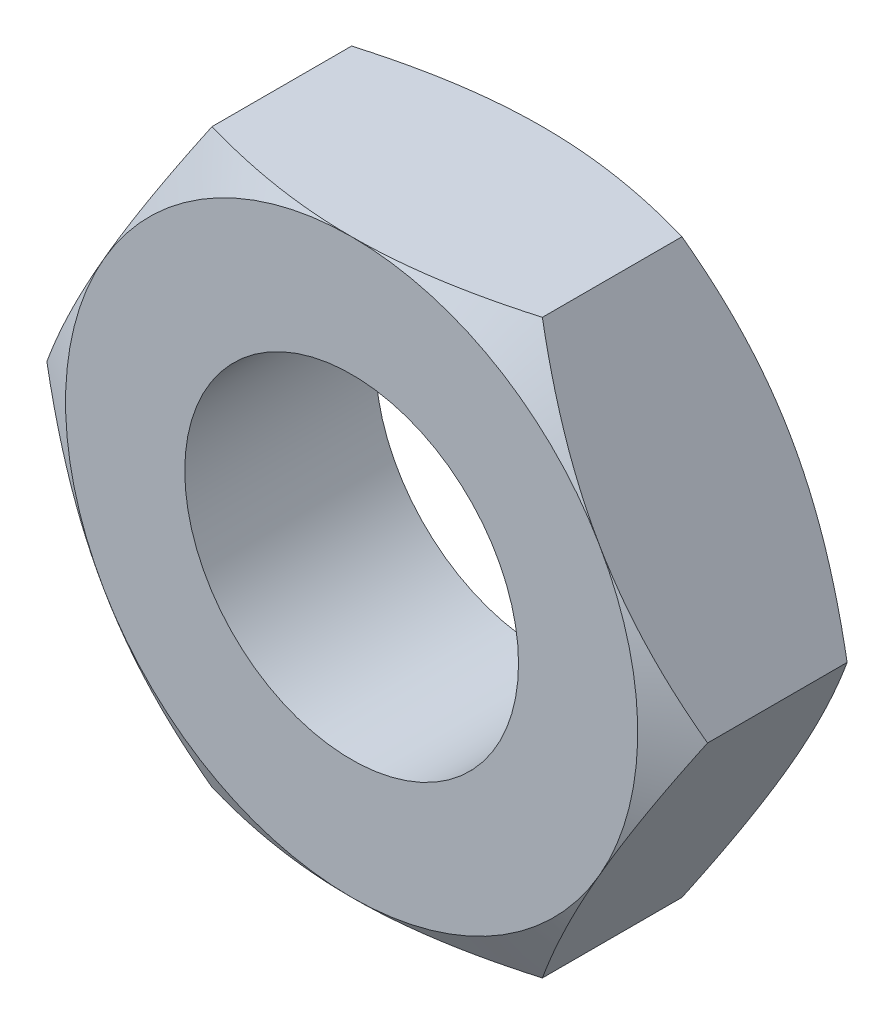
SolidWorks part; units mm, degrees
ref_plane "Front Plane" through (0, 0, 0) normal (0, 0, 1) x (1, 0, 0)
ref_plane "Top Plane" through (0, 0, 0) normal (0, 1, 0) x (1, 0, 0)
ref_plane "Right Plane" through (0, 0, 0) normal (1, 0, 0) x (0, 0, -1)
sketch "Sketch1" plane through (0, 0, 0) normal (0, 0, 1) x (1, 0, 0)
  line L1 (6.9282, 12) -> (-6.9282, 12)
  line L2 (-6.9282, 12) -> (-13.8564, 0)
  line L3 (-13.8564, 0) -> (-6.9282, -12)
  line L4 (-6.9282, -12) -> (6.9282, -12)
  line L5 (6.9282, -12) -> (13.8564, 0)
  line L6 (13.8564, 0) -> (6.9282, 12)
  circle A0 centre (0, 0) radius 12 construction
  dimension "D1" = 24
extrude "Extrude1" add sketch "Sketch1" along normal mid plane 8
sketch "Sketch2" plane through (0, 0, 0) normal (1, 0, 0) x (0, 0, -1)
  line L0 (-4, 12) -> (-4, 24)
  line L1 (-4, 24) -> (2.9282, 24)
  line L2 (2.9282, 24) -> (-4, 12)
  line L3 (0, 0) -> (6.7182, 0) construction
  dimension "D1" = 30
  dimension "D2" = 24
revolve "Cut-Revolve1" cut sketch "Sketch2" angle 360 about L3
mirror "Mirror1" about plane through (0, 0, 0) normal (0, 0, 1) of "Cut-Revolve1"
hole_wizard " Tapped Hole1" positions "Sketch4" profile "Sketch3" tap size "M16" standard "DIN"
sketch "Sketch4" plane through (0, 0, 4) normal (0, 0, 1) x (1, 0, 0)
  point P0 (0, 0)
sketch "Sketch3" plane through (0, 0, 4) normal (1, 0, 0) x (0, -1, 0)
  line L0 (0, 0) -> (0, 8)
  line L1 (0, 8) -> (7, 8)
  line L2 (7, 8) -> (7, 0)
  line L5 (7, 0) -> (0, 0)
  line L11 (0, -6.35) -> (0, 107.95) construction
  dimension "Thru Tap Drill Dia." = 14
  dimension "Thru Tap Drill Depth" = 8
